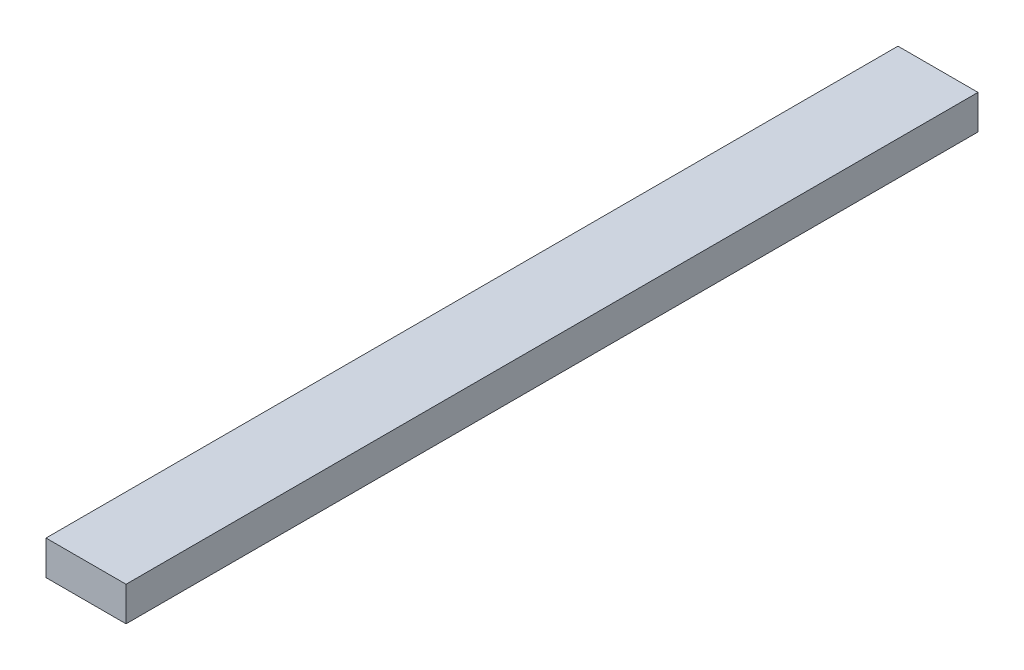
SolidWorks part; units mm, degrees
ref_plane "Front Plane" through (0, 0, 0) normal (0, 0, 1) x (1, 0, 0)
ref_plane "Top Plane" through (0, 0, 0) normal (0, 1, 0) x (1, 0, 0)
ref_plane "Right Plane" through (0, 0, 0) normal (1, 0, 0) x (0, 0, -1)
sketch "Sketch1" plane through (0, 0, 0) normal (0, 1, 0) x (1, 0, 0)
  line L1 (-44.45, -473.075) -> (44.45, -473.075)
  line L2 (-44.45, -473.075) -> (-44.45, 473.075)
  line L3 (-44.45, 473.075) -> (44.45, 473.075)
  line L4 (44.45, -473.075) -> (44.45, 473.075)
  line L5 (-44.45, -473.075) -> (44.45, 473.075) construction
  line L6 (-44.45, 473.075) -> (44.45, -473.075) construction
  point P0 (0, 0)
  dimension "D1" = 946.15
  dimension "D2" = 88.9
extrude "Boss-Extrude1" add sketch "Sketch1" along normal blind 38.1
